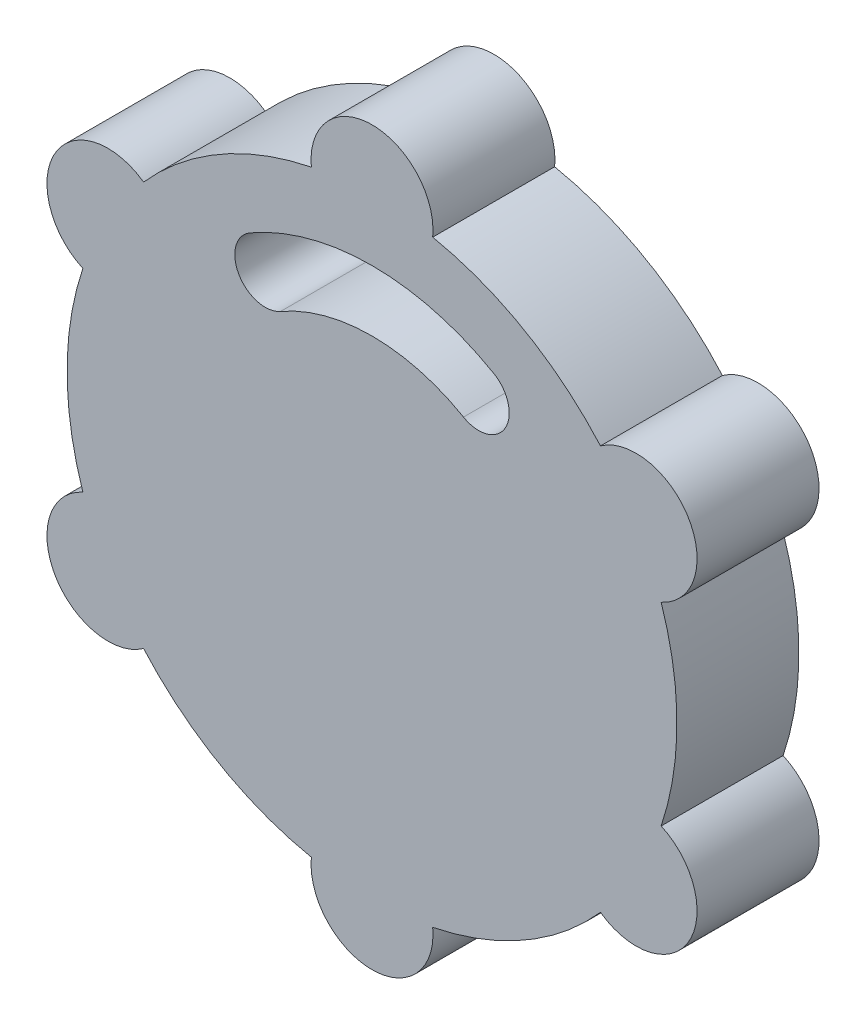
SolidWorks part; units mm, degrees
ref_plane "Plane1" through (0, 0, 0) normal (0, 0, 1) x (1, 0, 0)
ref_plane "Plane2" through (0, 0, 0) normal (0, 1, 0) x (1, 0, 0)
ref_plane "Plane3" through (0, 0, 0) normal (1, 0, 0) x (0, 0, -1)
sketch "Sketch1" plane through (0, 0, 0) normal (0, 0, 1) x (0.866, 0.5, 0)
  arc A0 (49, 9.9499) -> (33.1168, 37.4603) centre (0, 0) ccw
  arc A1 (49, -9.9499) -> (49, 9.9499) centre (50, 0) ccw
  arc A2 (15.8832, -47.4102) -> (33.1168, -37.4603) centre (25, -43.3013) ccw
  arc A3 (-33.1168, -37.4603) -> (-15.8832, -47.4102) centre (-25, -43.3013) ccw
  arc A4 (-49, 9.9499) -> (-49, -9.9499) centre (-50, 0) ccw
  arc A5 (-15.8832, 47.4102) -> (-33.1168, 37.4603) centre (-25, 43.3013) ccw
  arc A6 (33.1168, 37.4603) -> (15.8832, 47.4102) centre (25, 43.3013) ccw
  arc A7 (15.8832, 47.4102) -> (-15.8832, 47.4102) centre (0, 0) ccw
  arc A8 (-33.1168, 37.4603) -> (-49, 9.9499) centre (0, 0) ccw
  arc A9 (-49, -9.9499) -> (-33.1168, -37.4603) centre (0, 0) ccw
  arc A10 (-15.8832, -47.4102) -> (15.8832, -47.4102) centre (0, 0) ccw
  arc A11 (33.1168, -37.4603) -> (49, -9.9499) centre (0, 0) ccw
  arc A12 (25.9808, 15) -> (0, 30) centre (0, 0) ccw construction
  arc A13 (34.641, 20) -> (0, 40) centre (0, 0) ccw construction
  arc A14 (0, 40) -> (0, 30) centre (0, 35) ccw construction
  arc A15 (25.9808, 15) -> (34.641, 20) centre (30.3109, 17.5) ccw construction
  dimension "D1" = 100
  dimension "D4" = 10
  dimension "D5" = 30
  dimension "D6" = 30
  dimension "D8" = 10
  dimension "D7" = 60
extrude "Base-Extrude" add sketch "Sketch1" along normal blind 20
sketch "Sketch2" plane through (0, 0, 20) normal (0, 0, 1) x (1, 0, 0)
  arc A0 (-20, 34.641) -> (-15, 25.9808) centre (-17.5, 30.3109) ccw construction
  arc A1 (20, 34.641) -> (-20, 34.641) centre (0, 0) ccw construction
  arc A2 (15, 25.9808) -> (20, 34.641) centre (17.5, 30.3109) ccw construction
  arc A3 (15, 25.9808) -> (-15, 25.9808) centre (0, 0) ccw construction
  arc A4 (-20, 34.641) -> (-15, 25.9808) centre (-17.5, 30.3109) ccw
  arc A5 (20, 34.641) -> (-20, 34.641) centre (0, 0) ccw
  arc A6 (15, 25.9808) -> (20, 34.641) centre (17.5, 30.3109) ccw
  arc A7 (15, 25.9808) -> (-15, 25.9808) centre (0, 0) ccw
extrude "Cut-Extrude1" cut sketch "Sketch2" against normal blind 35
